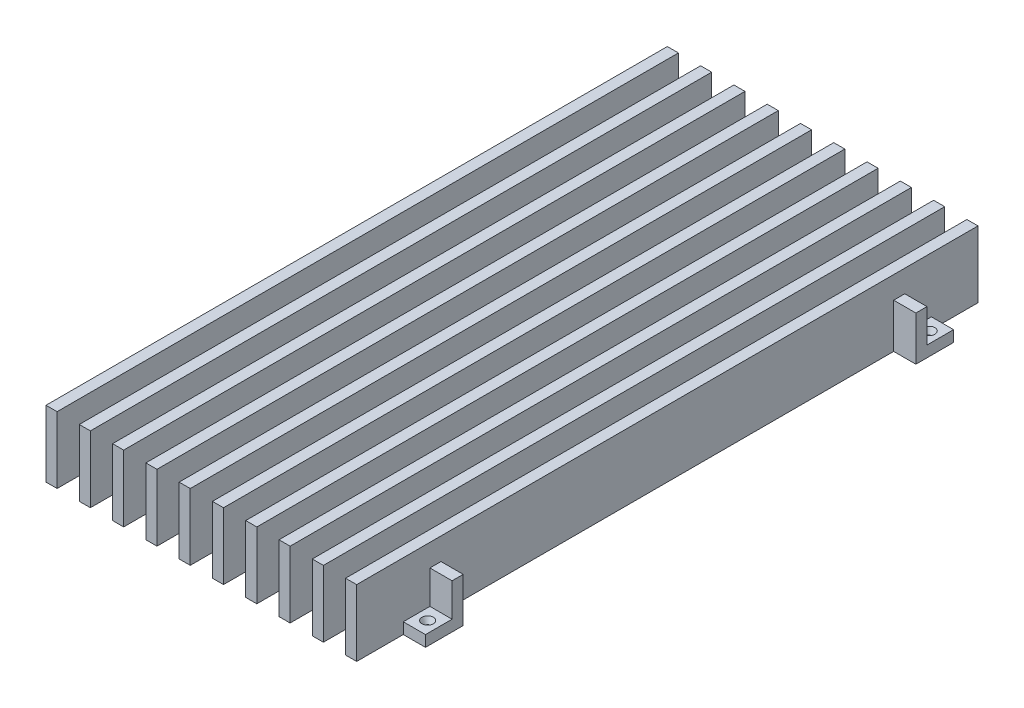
SolidWorks part; units mm, degrees
ref_plane "Front Plane" through (0, 0, 0) normal (0, 0, 1) x (1, 0, 0)
ref_plane "Top Plane" through (0, 0, 0) normal (0, 1, 0) x (1, 0, 0)
ref_plane "Right Plane" through (0, 0, 0) normal (1, 0, 0) x (0, 0, -1)
sketch "Sketch1" plane through (0, 0, 0) normal (0, 0, 1) x (1, 0, 0)
  line L1 (1.5875, -9.525) -> (-1.5875, -9.525)
  line L2 (1.5875, -9.525) -> (1.5875, 9.525)
  line L3 (1.5875, 9.525) -> (-1.5875, 9.525)
  line L4 (-1.5875, -9.525) -> (-1.5875, 9.525)
  line L5 (1.5875, -9.525) -> (-1.5875, 9.525) construction
  line L6 (1.5875, 9.525) -> (-1.5875, -9.525) construction
  point P0 (0, 0)
  dimension "D1" = 3.175
  dimension "D2" = 19.05
extrude "Boss-Extrude1" add sketch "Sketch1" against normal blind 177.8
pattern_linear "LPattern1" count 10 spacing 9.525 along (1, 0, 0)
ref_plane "Plane1" through (42.8625, 0, 0) normal (-1, 0, 0) x (0, 0, 1)
sketch "Sketch2" plane through (42.8625, 0, 0) normal (-1, 0, 0) x (0, 0, 1)
  line L0 (-177.8, -9.525) -> (0, -9.525) construction
  line L1 (-156.845, -9.525) -> (-153.67, -9.525)
  line L2 (-156.845, -9.525) -> (-156.845, 3.175)
  line L3 (-156.845, 3.175) -> (-153.67, 3.175)
  line L4 (-153.67, -9.525) -> (-153.67, 3.175)
  line L5 (-88.9, 9.525) -> (-88.9, -9.525) construction
  line L6 (-177.8, 9.525) -> (0, 9.525) construction
  line L7 (-24.13, -9.525) -> (-24.13, 3.175)
  line L8 (-20.955, 3.175) -> (-24.13, 3.175)
  line L9 (-20.955, -9.525) -> (-20.955, 3.175)
  line L10 (-20.955, -9.525) -> (-24.13, -9.525)
  dimension "D1" = 12.7
  dimension "D2" = 3.175
  dimension "D3" = 64.77
extrude "Boss-Extrude2" add sketch "Sketch2" along normal mid plane 101.6
ref_plane "Plane2" through (0, 0, -88.9) normal (0, 0, 1) x (1, 0, 0)
sketch "Sketch3" plane through (0, -9.525, 0) normal (0, -1, 0) x (1, 0, 0)
  line L0 (-7.9375, -20.955) -> (-7.9375, -24.13) construction
  line L1 (-1.5875, -20.955) -> (-7.9375, -20.955)
  line L2 (-1.5875, -20.955) -> (-1.5875, -13.335)
  line L3 (-1.5875, -13.335) -> (-7.9375, -13.335)
  line L4 (-7.9375, -20.955) -> (-7.9375, -13.335)
  line L5 (87.3125, -177.8) -> (87.3125, 0) construction
  line L6 (87.3125, -20.955) -> (93.6625, -20.955)
  line L7 (87.3125, -20.955) -> (87.3125, -13.335)
  line L8 (87.3125, -13.335) -> (93.6625, -13.335)
  line L9 (93.6625, -20.955) -> (93.6625, -13.335)
  line L10 (77.7875, -20.955) -> (84.1375, -20.955) construction
  line L11 (87.3125, -24.13) -> (93.6625, -24.13) construction
  line L12 (-7.9375, -156.845) -> (-1.5875, -156.845) construction
  line L13 (87.3125, -156.845) -> (93.6625, -156.845)
  line L14 (87.3125, -156.845) -> (87.3125, -164.465)
  line L15 (87.3125, -164.465) -> (93.6625, -164.465)
  line L16 (93.6625, -156.845) -> (93.6625, -164.465)
  line L17 (-1.5875, -156.845) -> (-7.9375, -156.845)
  line L18 (-1.5875, -156.845) -> (-1.5875, -164.465)
  line L19 (-1.5875, -164.465) -> (-7.9375, -164.465)
  line L20 (-7.9375, -156.845) -> (-7.9375, -164.465)
  line L21 (-1.5875, -177.8) -> (-1.5875, 0) construction
  dimension "D1" = 7.62
extrude "Boss-Extrude3" add sketch "Sketch3" against normal blind 3.175
sketch "Sketch4" plane through (0, -6.35, 0) normal (0, 1, 0) x (1, 0, 0)
  line L0 (93.6625, 164.465) -> (87.3125, 156.845) construction
  line L1 (93.6625, 156.845) -> (87.3125, 164.465) construction
  point P8 (90.4875, 160.655)
ref_plane "Plane3" through (0, 0, -160.655) normal (0, 0, -1) x (-1, 0, 0)
sketch "Sketch5" plane through (0, 0, -160.655) normal (0, 0, -1) x (-1, 0, 0)
  line L0 (-90.4875, -6.35) -> (-90.4875, -7.9375)
  line L1 (-90.4875, -7.9375) -> (-89.6938, -7.9375) construction
  line L2 (-89.6938, -7.9375) -> (-88.8497, -6.35)
  line L3 (-93.6625, -6.35) -> (-87.3125, -6.35) construction
  line L4 (-88.8497, -6.35) -> (-90.4875, -6.35)
  line L5 (-89.6938, -7.9375) -> (-89.6938, -9.525)
  line L6 (-87.3125, -9.525) -> (-93.6625, -9.525) construction
  line L7 (-90.4875, -7.9375) -> (-90.4875, -9.525)
  line L8 (-90.4875, -9.525) -> (-89.6938, -9.525)
  dimension "D1" = 1.5875
  dimension "D2" = 28
  dimension "D3" = 0.7937
revolve "Cut-Revolve1" cut sketch "Sketch5" angle 360 about L0
sketch "Sketch6" plane through (0, -6.35, 0) normal (0, 1, 0) x (1, 0, 0)
  line L0 (-1.5875, 156.845) -> (-7.9375, 164.465) construction
  line L1 (-7.9375, 156.845) -> (-1.5875, 164.465) construction
  line L2 (-1.5875, 13.335) -> (-7.9375, 20.955) construction
  line L3 (-7.9375, 13.335) -> (-1.5875, 20.955) construction
  point P0 (-4.7625, 160.655)
  point P1 (-4.7625, 17.145)
  point P2 (90.4875, 17.145)
pattern_sketch "Sketch-Pattern1" of "Cut-Revolve1"
ref_plane "Plane4" through (0, 0, -88.9) normal (0, 0, 1) x (1, 0, 0)
ref_plane "Plane5" through (42.8625, 0, 0) normal (-1, 0, 0) x (0, 0, 1)
